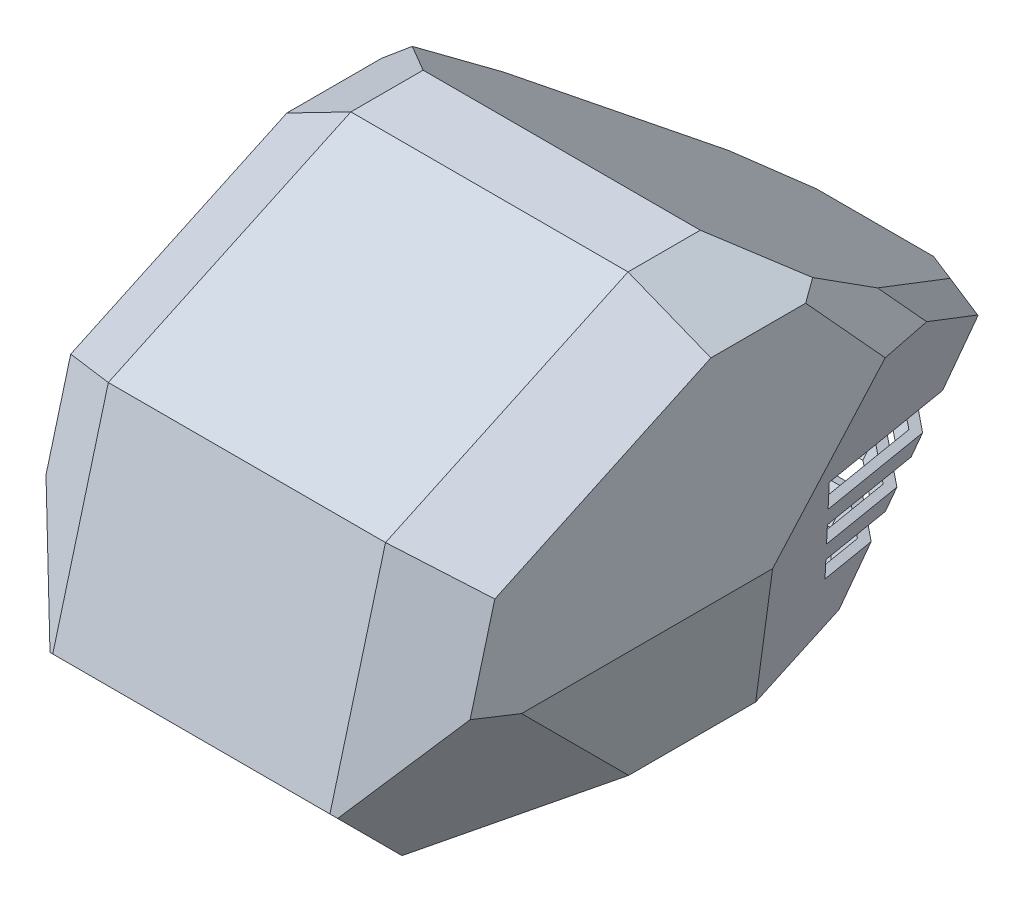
SolidWorks part; units mm, degrees
ref_plane "Plan de face" through (0, 0, 0) normal (0, 0, 1) x (1, 0, 0)
ref_plane "Plan de dessus" through (0, 0, 0) normal (0, 1, 0) x (1, 0, 0)
ref_plane "Plan de droite" through (0, 0, 0) normal (1, 0, 0) x (0, 0, -1)
sketch "Esquisse1" plane through (0, 0, 0) normal (1, 0, 0) x (0, 0, -1)
  line L0 (800, 150) -> (0, 150) construction
  line L1 (0, 0) -> (800, 0) construction
  line L2 (0, 0) -> (0, 600) construction
  line L3 (0, 600) -> (800, 600) construction
  line L4 (800, 0) -> (800, 600) construction
  line L8 (0, 46.1342) -> (0, 150) construction
  line L9 (0, 150) -> (634.5299, 150) construction
  line L13 (634.5299, 150) -> (750, 350)
  line L14 (750, 350) -> (392.963, 600)
  line L15 (392.963, 600) -> (316.2897, 600)
  line L16 (316.2897, 600) -> (58.9488, 480)
  line L17 (58.9488, 480) -> (0, 260)
  line L18 (0, 260) -> (110, 150)
  line L19 (750, 350) -> (800, 436.6025) construction
  line L20 (750, 350) -> (800, 350) construction
  line L21 (750, 350) -> (392.963, 350) construction
  line L22 (392.963, 350) -> (392.963, 600) construction
  line L23 (316.2897, 600) -> (316.2897, 480) construction
  line L24 (58.9488, 480) -> (316.2897, 480) construction
  line L25 (0, 260) -> (58.9488, 260) construction
  line L26 (58.9488, 480) -> (58.9488, 260) construction
  line L27 (110, 150) -> (634.5299, 150)
  line L28 (750, 350) -> (750, 600) construction
  line L29 (110, 150) -> (110, 260) construction
  line L30 (110, 260) -> (58.9488, 260) construction
  dimension "D1" = 800
  dimension "D2" = 600
  dimension "D3" = 150
  dimension "D4" = 60
  dimension "D5" = 200
  dimension "D6" = 35
  dimension "D7" = 50
  dimension "D8" = 15
  dimension "D9" = 25
  dimension "D10" = 45
  dimension "D11" = 110
  dimension "D12" = 330
extrude "Boss.-Extru.1" add sketch "Esquisse1" along normal blind 450
chamfer "Chanfrein1" distance 90 angle 70 2 edges at (450, 250, -692.265) (0, 250, -692.265)
chamfer "Chanfrein5" distance 35 angle 75 2 edges at (405, 150, -491.7668) (45, 150, -491.7668)
chamfer "Chanfrein6" distance 65 angle 70 2 edges at (450, 150, -171.2901) (0, 150, -171.2901)
chamfer "Chanfrein2" distance 45 angle 60 8 edges at (0, 404.293, -38.6632) (0, 540, -187.6192) (0, 600, -354.6263) (450, 404.293, -38.6632) (450, 540, -187.6192) (450, 600, -354.6263) (405.0184, 205, -55) (44.9816, 205, -55)
chamfer "Chanfrein7" distance 45 angle 40 2 edges at (333.1984, 250, -692.265) (116.8016, 250, -692.265)
chamfer "Chanfrein3" distance 30 angle 30 5 edges at (225, 350, -750) (408.6929, 439.7246, -621.8599) (41.3071, 439.7246, -621.8599) (332.6576, 366.6126, -726.2747) (117.3424, 366.6126, -726.2747)
chamfer "Chanfrein8" distance 30 angle 30 2 edges at (0, 512.1288, -503.7439) (450, 512.1288, -503.7439)
shell "Coque1" thickness 10
sketch "Esquisse2" plane through (0, 0, 0) normal (1, 0, 0) x (0, 0, -1)
  line L0 (719.442, 297.0719) -> (464.442, 365.399)
  line L2 (464.442, 365.399) -> (516.6332, 222.0049) construction
  line L3 (516.6332, 222.0049) -> (654.7372, 185)
  line L4 (654.7372, 185) -> (719.442, 297.0719) construction
  line L5 (516.6332, 222.0049) -> (548.9855, 342.7456) construction
  line L6 (464.442, 365.399) -> (479.0555, 325.2486)
  line L7 (479.0555, 325.2486) -> (701.3246, 265.6918)
  line L8 (701.3246, 265.6918) -> (719.442, 297.0719)
  line L9 (516.6332, 222.0049) -> (506.1949, 250.6837)
  line L10 (506.1949, 250.6837) -> (667.6782, 207.4144)
  line L11 (667.6782, 207.4144) -> (654.7372, 185)
  line L12 (487.4061, 302.3056) -> (497.8443, 273.6267)
  line L13 (497.8443, 273.6267) -> (678.0309, 225.3459)
  line L14 (678.0309, 225.3459) -> (690.9719, 247.7603)
  line L15 (690.9719, 247.7603) -> (487.4061, 302.3056)
  line L16 (654.7372, 185) -> (516.6332, 185) construction
  line L17 (516.6332, 222.0049) -> (516.6332, 185) construction
  line L19 (464.442, 365.399) -> (464.442, 150) construction
  line L20 (740.8442, 334.1417) -> (634.5299, 150) construction
  line L21 (567.8967, 150) -> (438.7936, 150) construction
  dimension "D1" = 35
  dimension "D2" = 25
  dimension "D3" = 25
  dimension "D4" = 20
  dimension "D5" = 20
  dimension "D6" = 35
  dimension "D7" = 15
  dimension "D8" = 35
  dimension "D9" = 255
extrude "Enlèv. mat.-Extru.1" cut sketch "Esquisse2" along normal through all contours L7 L8 L0 L6
